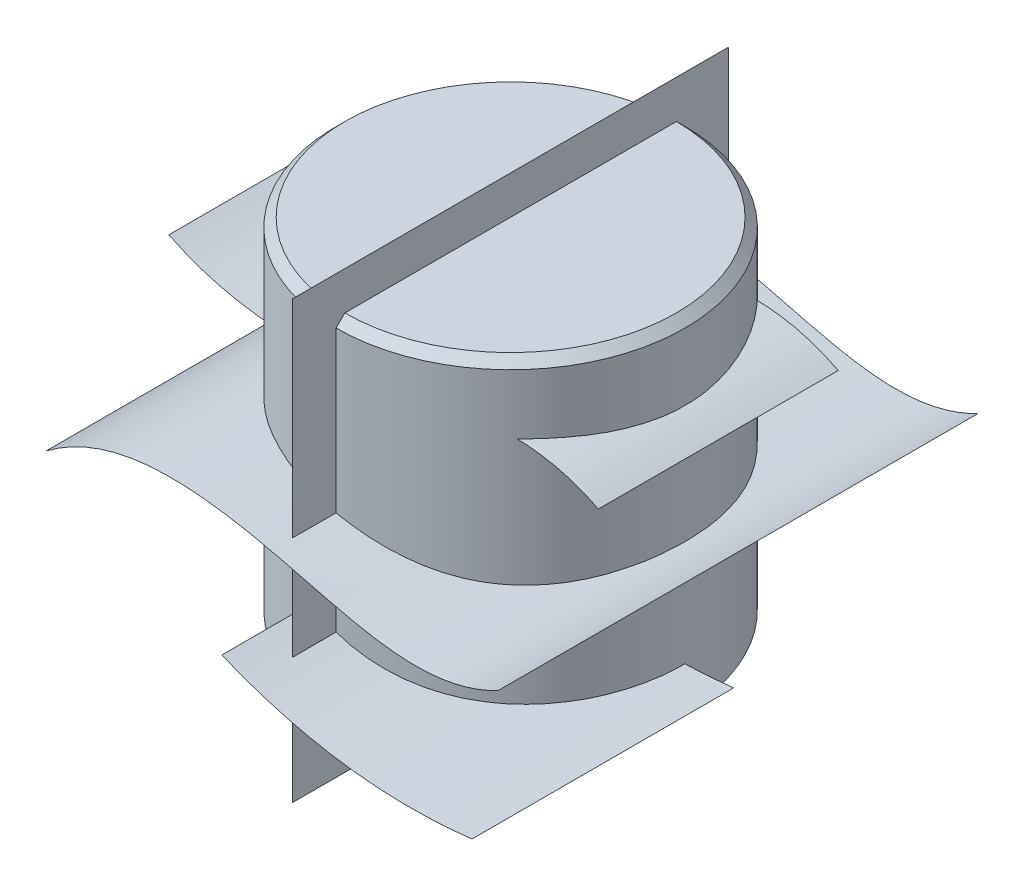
SolidWorks part; units mm, degrees
ref_plane "Front Plane" through (0, 0, 0) normal (0, 0, 1) x (1, 0, 0)
ref_plane "Top Plane" through (0, 0, 0) normal (0, 1, 0) x (1, 0, 0)
ref_plane "Right Plane" through (0, 0, 0) normal (1, 0, 0) x (0, 0, -1)
sketch "Sketch1" plane through (0, 0, 0) normal (0, 1, 0) x (1, 0, 0)
  circle A0 centre (0, 0) radius 40
  dimension "D1" = 80
extrude "Boss-Extrude1" add sketch "Sketch1" along normal blind 80
chamfer "Chamfer1" distance 2 angle 45 2 edges at (0, 0, 40) (0, 80, 40)
sketch "Sketch2" plane through (0, 0, 0) normal (0, 0, 1) x (1, 0, 0)
  spline S0 degree 3 poles (-50.8451, 64.8349) (-35.467, 57.3362) (-1.5741, 57.3525) (30.8861, 68.3023) (47.588, 59.6117) knots 0 0 0 0 0.492109 1 1 1 1
  dimension "D1" = 60
surface "Surface-Extrude1" sketch "Sketch2" parameters "D1"=55
sketch "Sketch3" plane through (0, 0, 0) normal (0, 0, 1) x (1, 0, 0)
  spline S0 degree 3 poles (-51.4909, 35.3484) (-34.3685, 48.3932) (2.6374, 42.0526) (36.2706, 31.3364) (52.1336, 39.6058) knots 0 0 0 0 0.555419 1 1 1 1
  dimension "D1" = 40
surface "Surface-Extrude2" sketch "Sketch3" parameters "D1"=110
sketch "Sketch4" plane through (0, 0, 0) normal (0, 0, 1) x (1, 0, 0)
  spline S0 degree 2 poles (-6.1957, 20) (21.3433, 8.5839) (51.1416, 12.1435) knots 0 0 0 1 1 1
  dimension "D1" = 20
surface "Surface-Extrude3" sketch "Sketch4" parameters "D1"=60
sketch "Sketch6" plane through (0, 0, 0) normal (1, 0, 0) x (0, 0, -1)
  line L1 (-50, 88.7988) -> (50, 88.7988)
  line L2 (-50, 88.7988) -> (-50, -11.2012)
  line L3 (-50, -11.2012) -> (50, -11.2012)
  line L4 (50, 88.7988) -> (50, -11.2012)
  line L5 (-50, 88.7988) -> (50, -11.2012) construction
  line L6 (-50, -11.2012) -> (50, 88.7988) construction
  point P0 (0, 38.7988)
  dimension "D1" = 100
  dimension "D2" = 100
surface "Surface-Plane1" sketch "Sketch6"
sketch "Sketch5" plane through (0, 0, 0) normal (1, 0, 0) x (0, 0, -1)
  line L0 (0, 80) -> (50, 130) construction
  line L1 (40, 80) -> (-40, 80) construction
  dimension "D1" = 45
  dimension "D2" = 50
